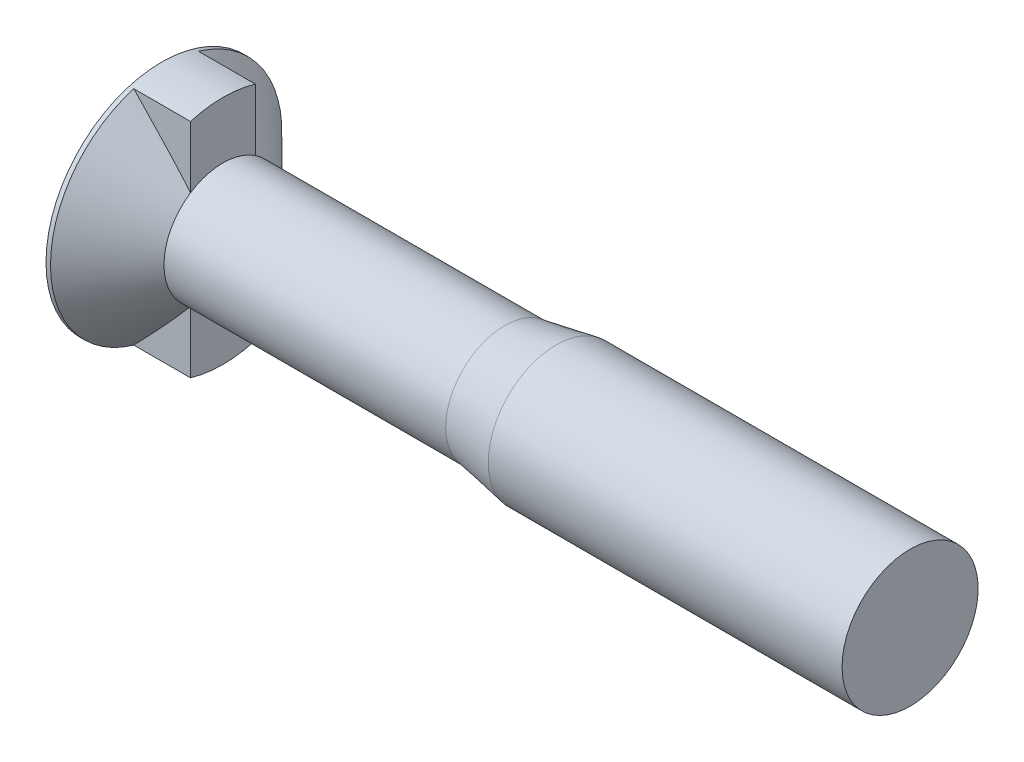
SolidWorks part; units mm, degrees
ref_plane "Front" through (0, 0, 0) normal (0, 0, 1) x (1, 0, 0)
ref_plane "Top" through (0, 0, 0) normal (0, 1, 0) x (1, 0, 0)
ref_plane "Right" through (0, 0, 0) normal (1, 0, 0) x (0, 0, -1)
other "Configuration Table"
sketch "Sketch2" plane through (0, 0, 0) normal (0, 0, 1) x (1, 0, 0)
  line L0 (-4.9405, 0) -> (36.2951, 0) construction
  line L1 (0, 0) -> (0, 8.5)
  line L2 (0, 8.5) -> (0.33, 8.5)
  line L3 (0.33, 8.5) -> (4.5, 4.33)
  line L4 (4.5, 4.33) -> (25.2, 4.33)
  line L5 (55, 5) -> (55, 0)
  line L6 (55, 0) -> (0, 0)
  line L7 (25.2, 4.33) -> (29, 5)
  line L8 (29, 5) -> (55, 5)
revolve "Base" add sketch "Sketch2" angle 360 about L0
sketch "Sketch3" plane through (0, 0, 0) normal (0, 0, 1) x (1, 0, 0)
  line L0 (-0.9415, 0) -> (6.8139, 0) construction
  line L2 (0, 8.5) -> (4.5, 8.5)
  line L4 (4.5, 8.5) -> (4.5, -8.5)
  line L5 (4.5, -8.5) -> (0, -8.5)
  line L6 (0, -8.5) -> (0, 8.5)
  line L8 (0, 8.5) -> (0, -8.5) construction
extrude "Nib" add sketch "Sketch3" along normal mid plane 4.76
sketch "Sketch4" plane through (0, 0, 0) normal (-1, 0, 0) x (0, 0, 1)
  circle A0 centre (0, 0) radius 8.5 construction
  circle A1 centre (0, 0) radius 8.5
extrude "Cut-Extrude1" cut sketch "Sketch4" against normal through all flip side to cut
sketch "Sketch5" plane through (0, 0, 0) normal (0, 0, 1) x (1, 0, 0)
  line L0 (54.3878, 6.2244) -> (55.6122, 6.2244)
  line L1 (55.6122, 6.2244) -> (55.6122, 5)
  line L2 (55.6122, 5) -> (55, 3.9396)
  line L3 (54.3878, 5) -> (55, 3.9396)
  line L4 (54.3878, 6.2244) -> (54.3878, 5)
  line L5 (55, 0) -> (0, 0) construction
  line L6 (54.3878, 5) -> (55.6122, 5) construction
  line L7 (55, 5) -> (55, 3.9396) construction
  line L9 (55, 5) -> (29, 5) construction
  line L10 (55, -5) -> (55, 5) construction
  point P5 (55, 6.2244)
revolve "Cut-Revolve10" [suppressed] cut sketch "Sketch5" angle 360 about L5
pattern_linear "LPattern10" [suppressed] count 18 spacing 1.4693 along (1, 0, 0)
equation "\"D1@Sketch3\" = \"dk@Sketch2\""
equation "\"D2@Sketch3\" = \"k@Sketch2\""
equation "\"D2@Sketch5\" =  ( \"d@Sketch2\" - \"D2@ThreadCosmetic1\" )  / 2"
equation "\"D3@LPattern10\" = \"D2@Sketch5\" * 1.2"
equation "\"D1@LPattern10\" = \"b@Sketch2\" / \"D3@LPattern10\""
